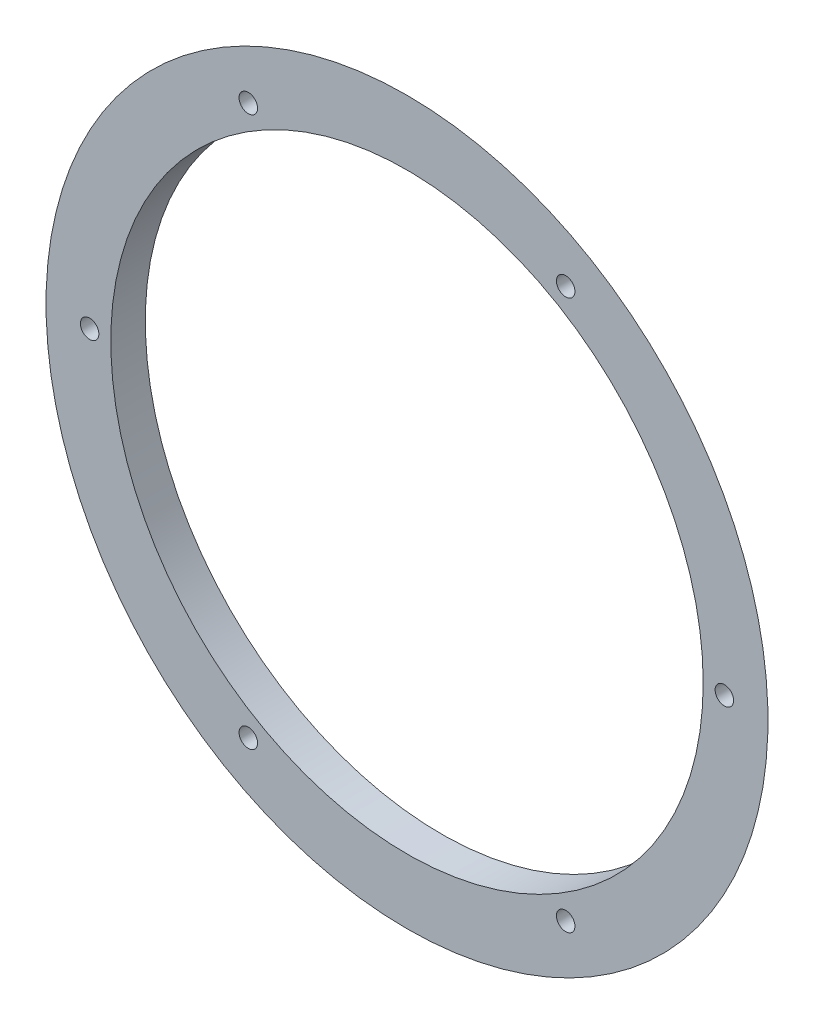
SolidWorks part; units mm, degrees
ref_plane "Front Plane" through (0, 0, 0) normal (0, 0, 1) x (1, 0, 0)
ref_plane "Top Plane" through (0, 0, 0) normal (0, 1, 0) x (1, 0, 0)
ref_plane "Right Plane" through (0, 0, 0) normal (1, 0, 0) x (0, 0, -1)
sketch "Sketch1" plane through (0, 0, 0) normal (0, 0, 1) x (1, 0, 0)
  circle A0 centre (0, 0) radius 99.6696
  circle A1 centre (0, 0) radius 81.788
  dimension "D1" = 163.576
  dimension "D2" = 199.3392
extrude "Boss-Extrude1" add sketch "Sketch1" against normal blind 9.525
hole_wizard "#10 Clearance Hole1" positions "Sketch3" profile "Sketch2" hole size "#10" standard "ANSI Inch"
sketch "Sketch3" plane through (0, 0, 0) normal (0, 0, 1) x (1, 0, 0)
  circle A0 centre (0, 0) radius 87.63 construction
  point P0 (-87.63, 0)
  point P15 (-43.815, 75.8898)
  point P16 (43.815, 75.8898)
  point P17 (87.63, 0)
  point P18 (43.815, -75.8898)
  point P19 (-43.815, -75.8898)
  dimension "D2" = 6
sketch "Sketch2" plane through (-87.63, 0, 0) normal (1, 0, 0) x (0, -1, 0)
  line L0 (0, 0) -> (0, 9.525)
  line L1 (0, 9.525) -> (2.5527, 9.525)
  line L2 (2.5527, 9.525) -> (2.5527, 0)
  line L5 (2.5527, 0) -> (0, 0)
  line L11 (0, -6.35) -> (0, 107.95) construction
  dimension "Thru Hole Dia." = 5.1054
  dimension "Thru Hole Depth" = 9.525
sketch "Sketch4" plane through (0, 0, 0) normal (1, 0, 0) x (0, 0, -1)
  line L0 (0, 0) -> (-154.4831, 0) construction
  line L1 (0, 99.6696) -> (-154.4831, 0) construction
  line L2 (9.525, 83.0686) -> (-154.4831, 0) construction
  line L3 (9.525, -99.6696) -> (9.525, 99.6696) construction
  line L4 (9.525, 83.0686) -> (25.0626, 83.0686)
  line L5 (25.0626, 83.0686) -> (25.0626, 117.3648)
  line L6 (25.0626, 117.3648) -> (0, 117.3648)
  line L7 (0, 117.3648) -> (0, 99.6696)
  arc A0 (9.525, 83.0686) -> (0, 99.6696) centre (-154.4831, 0) ccw
  dimension "D1" = 183.8452
  dimension "D2" = 99.6696
revolve "Cut-Revolve1" cut sketch "Sketch4" angle 360 about L0
equation "\"Buoyancy\"=\"SW-Volume\"*(\"SW-Density\"-.037062)"
